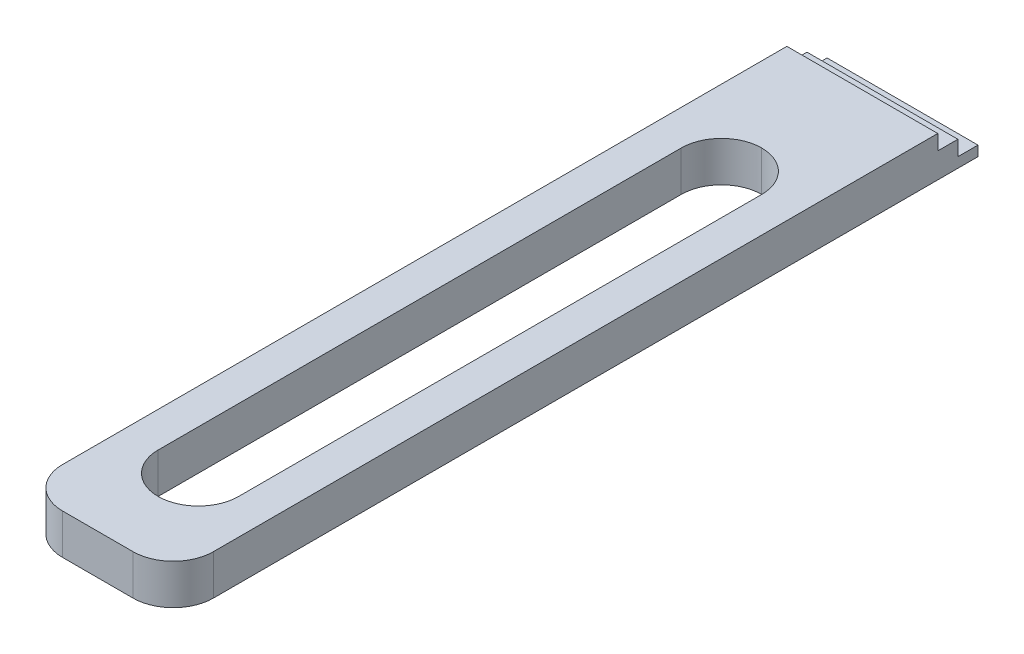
SolidWorks part; units mm, degrees
ref_plane "Спереди" through (0, 0, 0) normal (0, 0, 1) x (1, 0, 0)
ref_plane "Сверху" through (0, 0, 0) normal (0, 1, 0) x (1, 0, 0)
ref_plane "Справа" through (0, 0, 0) normal (1, 0, 0) x (0, 0, -1)
sketch "Эскиз1" plane through (0, 0, 0) normal (0, 1, 0) x (1, 0, 0)
  line L1 (-15.4687, 48.7983) -> (-0.4687, 48.7983)
  line L2 (-15.4687, 48.7983) -> (-15.4687, -31.2017)
  line L3 (-15.4687, -31.2017) -> (-0.4687, -31.2017)
  line L4 (-0.4687, 48.7983) -> (-0.4687, -31.2017)
  line L5 (-11.9687, 34.7983) -> (-3.9687, 34.7983)
  line L6 (-11.9687, 34.7983) -> (-11.9687, -25.2017)
  line L7 (-11.9687, -25.2017) -> (-3.9687, -25.2017)
  line L8 (-3.9687, 34.7983) -> (-3.9687, -25.2017)
  dimension "D1" = 15
  dimension "D2" = 80
  dimension "D3" = 8
  dimension "D4" = 60
  dimension "D5" = 3.5
  dimension "D6" = 6
extrude "Бобышка-Вытянуть1" add sketch "Эскиз1" along normal blind 4
fillet "Скругление1" radius 4 6 edges at (-0.4687, 2, 31.2017) (-15.4687, 2, 31.2017) (-3.9687, 2, 25.2017) (-11.9687, 2, 25.2017) (-3.9687, 2, -34.7983) (-11.9687, 2, -34.7983)
sketch "Эскиз2" plane through (0, 4, 0) normal (0, 1, 0) x (1, 0, 0)
  line L0 (-0.4687, -27.2017) -> (-0.4687, 48.7983) construction
  line L1 (-15.4687, 48.7983) -> (-0.4687, 48.7983)
  line L2 (-15.4687, 48.7983) -> (-15.4687, 44.7983)
  line L3 (-15.4687, 44.7983) -> (-0.4687, 44.7983)
  line L4 (-0.4687, 48.7983) -> (-0.4687, 44.7983)
  dimension "D1" = 4
extrude "Вырез-Вытянуть1" cut sketch "Эскиз2" against normal blind 1.5
sketch "Эскиз3" plane through (0, 2.5, 0) normal (0, 1, 0) x (1, 0, 0)
  line L1 (-15.4687, 48.7983) -> (-0.4687, 48.7983)
  line L2 (-15.4687, 48.7983) -> (-15.4687, 46.7983)
  line L3 (-15.4687, 46.7983) -> (-0.4687, 46.7983)
  line L4 (-0.4687, 48.7983) -> (-0.4687, 46.7983)
  dimension "D1" = 2
extrude "Вырез-Вытянуть2" cut sketch "Эскиз3" against normal blind 1.5
